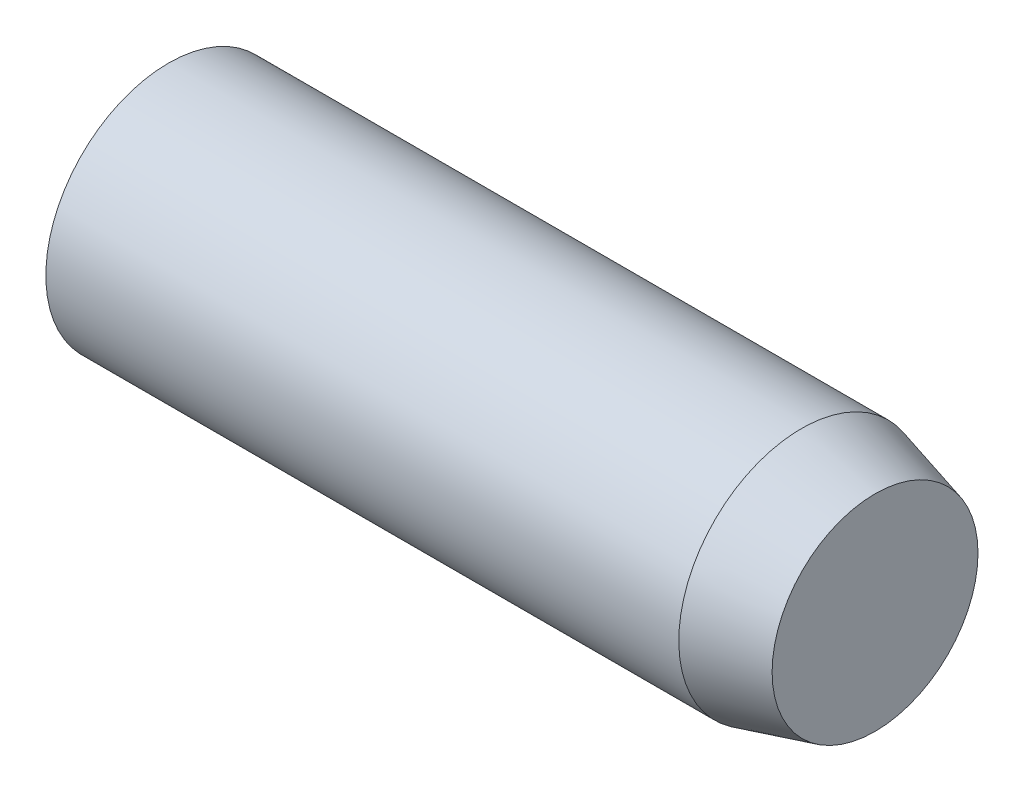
SolidWorks part; units mm, degrees
ref_plane "Plane1" through (0, 0, 0) normal (0, 0, 1) x (1, 0, 0)
ref_plane "Plane2" through (0, 0, 0) normal (0, 1, 0) x (1, 0, 0)
ref_plane "Plane3" through (0, 0, 0) normal (1, 0, 0) x (0, 0, -1)
other "Configuration Table"
sketch "BodySke" plane through (0, 0, 0) normal (0, 0, 1) x (1, 0, 0)
  line L0 (0, 0) -> (40.9091, 0) construction
  line L1 (27, 5) -> (30, 4.1962)
  line L2 (1.2, 5) -> (27, 5)
  line L3 (30, 4.1962) -> (30, 0)
  line L4 (0, 0) -> (30, 0)
  arc A0 (1.2, 5) -> (0, 0) centre (11.0167, 0) ccw
  dimension "D1" = 15
  dimension "Diameter" = 10
  dimension "Length" = 30
  dimension "Crown_ht" = 1.2
  dimension "Chamfer_len" = 3
revolve "Body" add sketch "BodySke" angle 360 about L0
equation "' \"D1@BodySke\" = \"Length@BodySke\""
